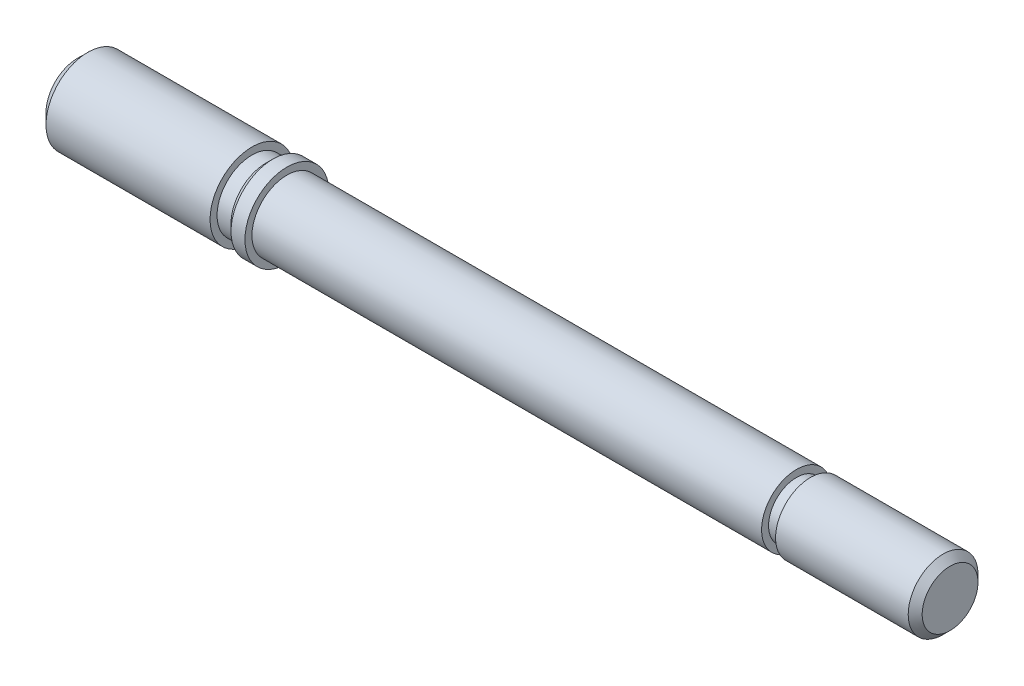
SolidWorks part; units mm, degrees
ref_plane "Plan de face" through (0, 0, 0) normal (0, 0, 1) x (1, 0, 0)
ref_plane "Plan de dessus" through (0, 0, 0) normal (0, 1, 0) x (1, 0, 0)
ref_plane "Plan de droite" through (0, 0, 0) normal (1, 0, 0) x (0, 0, -1)
sketch "Esquisse1" plane through (0, 0, 0) normal (0, 0, 1) x (1, 0, 0)
  line L0 (-8.3877, 0) -> (153.5255, 0) construction
  line L1 (0, 0) -> (0, 4.5)
  line L2 (0, 4.5) -> (1.5, 6)
  line L3 (1.5, 6) -> (25, 6)
  line L4 (25, 6) -> (25, 5)
  line L5 (25, 5) -> (27, 5)
  line L6 (27, 5) -> (28, 6)
  line L7 (28, 6) -> (30, 6)
  line L8 (30, 6) -> (30, 5)
  line L9 (30, 5) -> (103, 5)
  line L10 (103, 4) -> (105, 4)
  line L11 (105, 4) -> (105, 5)
  line L12 (105, 5) -> (124, 5)
  line L13 (124, 5) -> (125, 4)
  line L14 (125, 4) -> (125, 0)
  line L15 (103, 5) -> (103, 4)
  line L16 (0, 0) -> (125, 0)
  dimension "D1" = 22
  dimension "D2" = 2
  dimension "D3" = 1
  dimension "D4" = 45
  dimension "D5" = 5
  dimension "D6" = 4
  dimension "D7" = 1.5
  dimension "D8" = 45
  dimension "D9" = 6
  dimension "D10" = 5
  dimension "D11" = 3
  dimension "D12" = 1
  dimension "D13" = 25
  dimension "D14" = 2
  dimension "D15" = 125
revolve "Révolution1" add sketch "Esquisse1" angle 360 about L0
